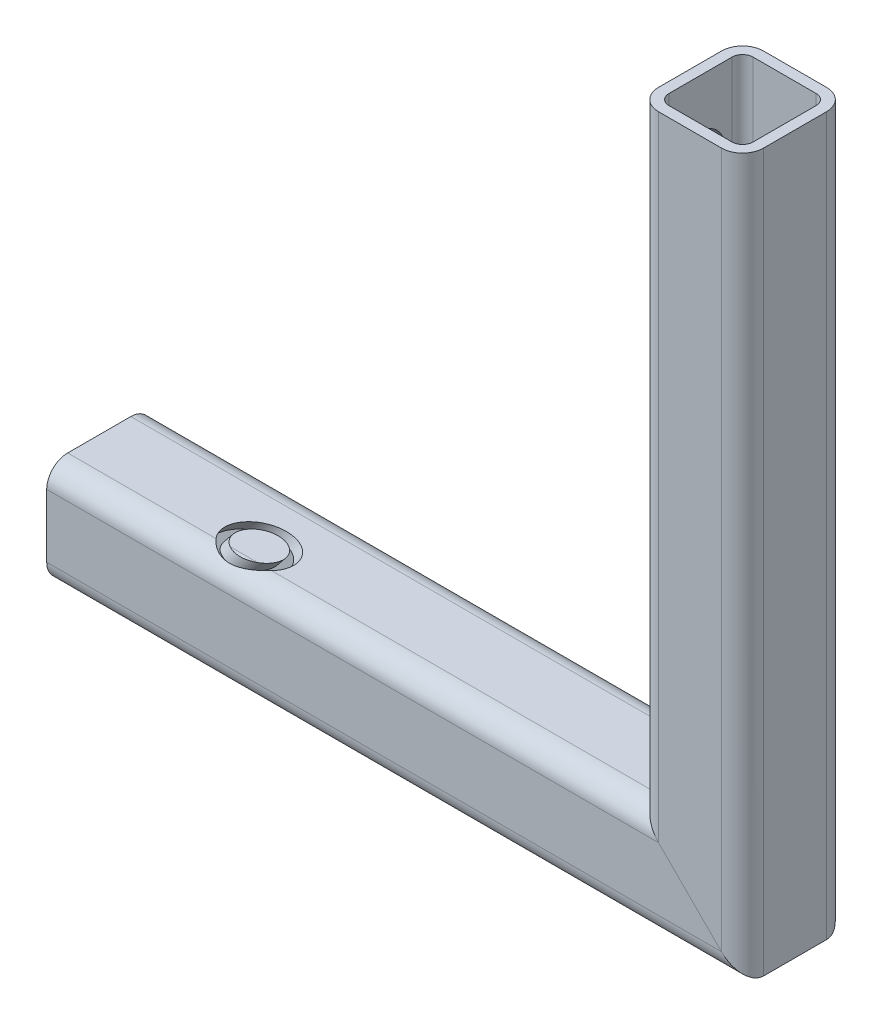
SolidWorks part; units mm, degrees
ref_plane "Ebene vorne" through (0, 0, 0) normal (0, 0, 1) x (1, 0, 0)
ref_plane "Ebene oben" through (0, 0, 0) normal (0, 1, 0) x (1, 0, 0)
ref_plane "Ebene rechts" through (0, 0, 0) normal (1, 0, 0) x (0, 0, -1)
sketch "Skizze1" plane through (0, 0, 0) normal (0, 0, 1) x (1, 0, 0)
  line L0 (-244.8578, 0) -> (0, 0)
  line L1 (0, 0) -> (0, 252.9255)
other "Strukturbauteil1"
ref_plane "Ebene1" through (-244.8578, 0, 0) normal (1, 0, 0) x (0, 0, 1)
sketch "Sketch1" plane through (-244.8578, 0, 0) normal (1, 0, 0) x (0, 0, 1)
  line L0 (-12, -16) -> (12, -16)
  line L1 (-16, -12) -> (-16, 12)
  line L2 (12, 16) -> (-12, 16)
  line L3 (16, 12) -> (16, -12)
  line L4 (-12, -20) -> (12, -20)
  line L5 (-20, -12) -> (-20, 12)
  line L6 (12, 20) -> (-12, 20)
  line L7 (20, 12) -> (20, -12)
  arc A0 (20, 12) -> (12, 20) centre (12, 12) ccw
  arc A1 (12, -20) -> (20, -12) centre (12, -12) ccw
  arc A2 (-20, -12) -> (-12, -20) centre (-12, -12) ccw
  arc A3 (-12, 20) -> (-20, 12) centre (-12, 12) ccw
  arc A4 (-12, 16) -> (-16, 12) centre (-12, 12) ccw
  arc A5 (16, 12) -> (12, 16) centre (12, 12) ccw
  arc A6 (12, -16) -> (16, -12) centre (12, -12) ccw
  arc A7 (-16, -12) -> (-12, -16) centre (-12, -12) ccw
  point P0 (-20, 0)
  point P1 (20, 0)
  point P2 (0, 20)
  point P3 (0, -20)
  point P4 (0, 0)
  point P5 (-20, -20)
  point P6 (20, -20)
  point P7 (20, 20)
  point P8 (-20, 20)
  point P33 (0, 0)
  dimension "D1" = 8
  dimension "Thickness" = 4
  dimension "V_leg" = 40
sketch3d "3D-Skizze1"
  point P0 (-177.6617, 20, 6.2699)
  point P1 (-20, 213.3836, -0.4559)
other "Formnest1"
other "Rundrohr<1>@PRFRAHMEN MIT RUNDROHR1"
equation "\"LÄNGE\"=0"
equation "\"BREITE\"=0"
equation "\"HÖHE\"=0"
equation "\"DURCHMESSER\"=0"
equation "\"Stückzahl\"= 1"
